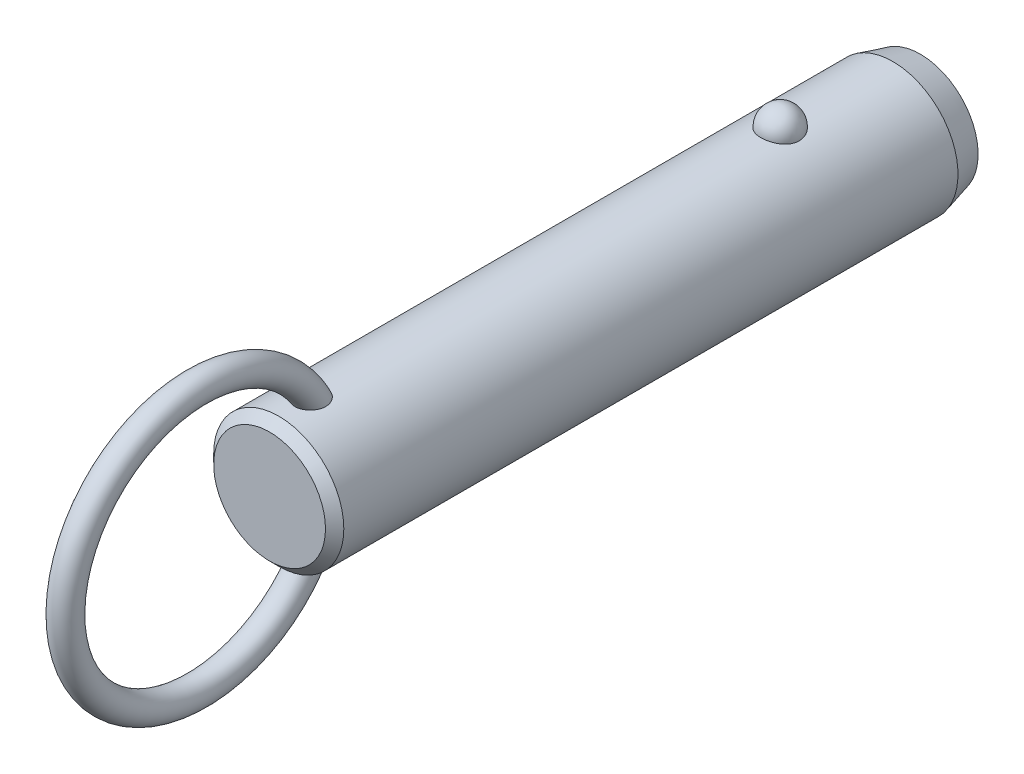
SolidWorks part; units mm, degrees
ref_plane "Front Plane" through (0, 0, 0) normal (0, 0, 1) x (1, 0, 0)
ref_plane "Top Plane" through (0, 0, 0) normal (0, 1, 0) x (1, 0, 0)
ref_plane "Right Plane" through (0, 0, 0) normal (1, 0, 0) x (0, 0, -1)
sketch "Sketch2" plane through (0, 0, 0) normal (0, 0, 1) x (1, 0, 0)
  circle A0 centre (0, 0) radius 7.1
  point P3 (0, 7.1)
  dimension "D1" = 14.2
extrude "Boss-Extrude1" add sketch "Sketch2" along normal blind 45.7
sketch "Sketch3" plane through (0, 0, 0) normal (0, 0, -1) x (-1, 0, 0)
  circle A0 centre (0, 0) radius 7.1
  dimension "D1" = 14.2
extrude "Boss-Extrude2" add sketch "Sketch3" along normal blind 17.4
chamfer "Chamfer1" distance 3 angle 15 1 edges at (-7.1, 0, -17.4)
sketch "Sketch12" plane through (0, 0, 0) normal (1, 0, 0) x (0, 0, -1)
  line L0 (-45.7, 7.1) -> (-45.7, -7.1) construction
  point P0 (-45.7, 0)
sketch "Sketch13" plane through (0, 0, 0) normal (1, 0, 0) x (0, 0, -1)
  circle A0 centre (-61.55, 0) radius 15.85
  point P2 (-45.7, 0)
  dimension "D1" = 31.7
sketch "Sketch14" plane through (0, 0, 0) normal (0, 1, 0) x (1, 0, 0)
  circle A0 centre (0, -47.2) radius 1.5
  point P2 (0, -45.7)
  dimension "D1" = 3
sweep "Sweep1" add profiles "Sketch14" path "Sketch13"
sketch "Sketch15" plane through (0, 0, 45.7) normal (0, 0, 1) x (1, 0, 0)
  circle A0 centre (0, 0) radius 7.1
  dimension "D1" = 14.2
extrude "Boss-Extrude3" add sketch "Sketch15" along normal blind 7.92
chamfer "Chamfer2" distance 1 angle 45 1 edges at (7.1, 0, 53.62)
sketch "Sketch18" plane through (0, 0, 0) normal (1, 0, 0) x (0, 0, -1)
  line L0 (14.4, 7.1) -> (-47.3792, 7.1) construction
  line L1 (2.1, 9.2) -> (2.1, 5)
  line L2 (-47.3792, -7.1) -> (14.4, -7.1) construction
  arc A0 (2.1, 9.2) -> (2.1, 5) centre (2.1, 7.1) ccw
  point P4 (0, 7.1)
  dimension "D1" = 16.3
revolve "Revolve1" add sketch "Sketch18" angle 360 about L1
